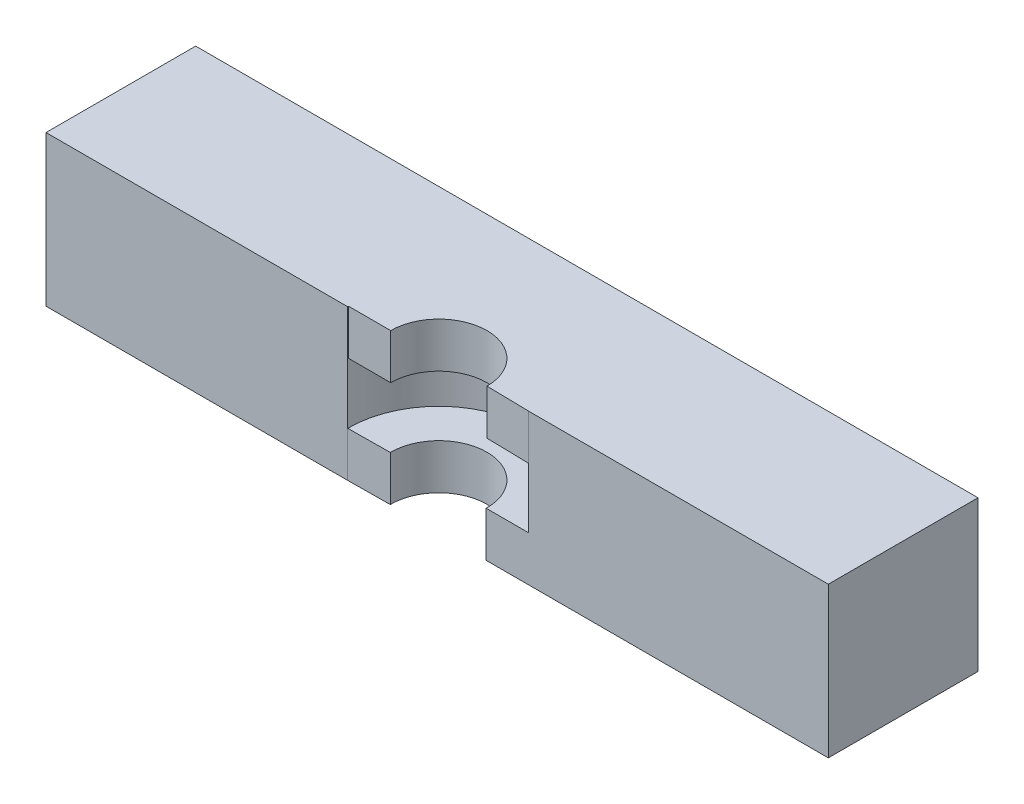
SolidWorks part; units mm, degrees
ref_plane "前视基准面" through (0, 0, 0) normal (0, 0, 1) x (1, 0, 0)
ref_plane "上视基准面" through (0, 0, 0) normal (0, 1, 0) x (1, 0, 0)
ref_plane "右视基准面" through (0, 0, 0) normal (1, 0, 0) x (0, 0, -1)
other "Configuration Table"
sketch "草图1" plane through (0, 0, 0) normal (0, 1, 0) x (1, 0, 0)
  line L1 (0, 0) -> (0.7, 0)
  line L2 (0, 0) -> (0, 0.7)
  line L3 (0, 0.7) -> (0.7, 0.7)
  line L4 (0.7, 0) -> (0.7, 0.7)
  dimension "D1" = 0.7
  dimension "D2" = 0.7
extrude "凸台-拉伸1" add sketch "草图1" along normal blind 0.5
sketch "草图2" plane through (0, 0.5, 0) normal (0, 1, 0) x (1, 0, 0)
  line L1 (0, 0) -> (2.6, 0)
  line L2 (0, 0) -> (0, 2.6)
  line L3 (0, 2.6) -> (2.6, 2.6)
  line L4 (2.6, 0) -> (2.6, 2.6)
  dimension "D1" = 2.6
  dimension "D2" = 2.6
extrude "凸台-拉伸2" add sketch "草图2" against normal blind 0.5
sketch "草图3" plane through (0, 0.5, 0) normal (0, 1, 0) x (1, 0, 0)
  circle A0 centre (1.3028, 1.3028) radius 0.3
extrude "切除-拉伸1" cut sketch "草图3" against normal blind 0.5
sketch "草图4" plane through (0, 0, 0) normal (0, -1, 0) x (1, 0, 0)
  line L0 (2.6, 0) -> (2.6, -2.6) construction
  line L1 (0, 0) -> (2.6, 0)
  line L2 (0, 0) -> (0, -1.3)
  line L3 (0, -1.3) -> (2.6, -1.3)
  line L4 (2.6, 0) -> (2.6, -1.3)
extrude "切除-拉伸2" cut sketch "草图4" against normal blind 0.5
sketch "草图5" plane through (0, 0, 0) normal (0, -1, 0) x (1, 0, 0)
  line L0 (1.3028, -1.3028) -> (0.9994, -1.3)
  line L1 (1.6028, -1.3) -> (1.4628, -1.3)
  line L2 (0, -1.3) -> (1.0028, -1.3) construction
  circle A0 centre (1.3028, -1.3028) radius 0.16
  circle A1 centre (1.3028, -1.3028) radius 0.3
extrude "凸台-拉伸6" add sketch "草图5" against normal blind 0.15 contours A0 L0 L1 M8
sketch "草图6" plane through (0, 0.5, 0) normal (0, 1, 0) x (1, 0, 0)
  line L0 (1.1428, 1.3028) -> (1.0028, 1.3028)
  line L1 (1.4628, 1.3028) -> (1.6028, 1.3)
  circle A0 centre (1.3028, 1.3028) radius 0.3
  circle A1 centre (1.3028, 1.3028) radius 0.16
extrude "凸台-拉伸7" add sketch "草图6" against normal blind 0.15 contours A1 L1 L0 M5
sketch "草图7" plane through (0, 0, 0) normal (0, -1, 0) x (1, 0, 0)
  line L1 (0, -2.6) -> (0, -1.3) construction
  line L3 (0, -1.7975) -> (2.6, -1.7975)
  line L4 (0, -1.7975) -> (0, -2.6)
  line L5 (0, -2.6) -> (2.6, -2.6)
  line L6 (2.6, -1.7975) -> (2.6, -2.6)
extrude "切除-拉伸3" cut sketch "草图7" against normal blind 1.15
